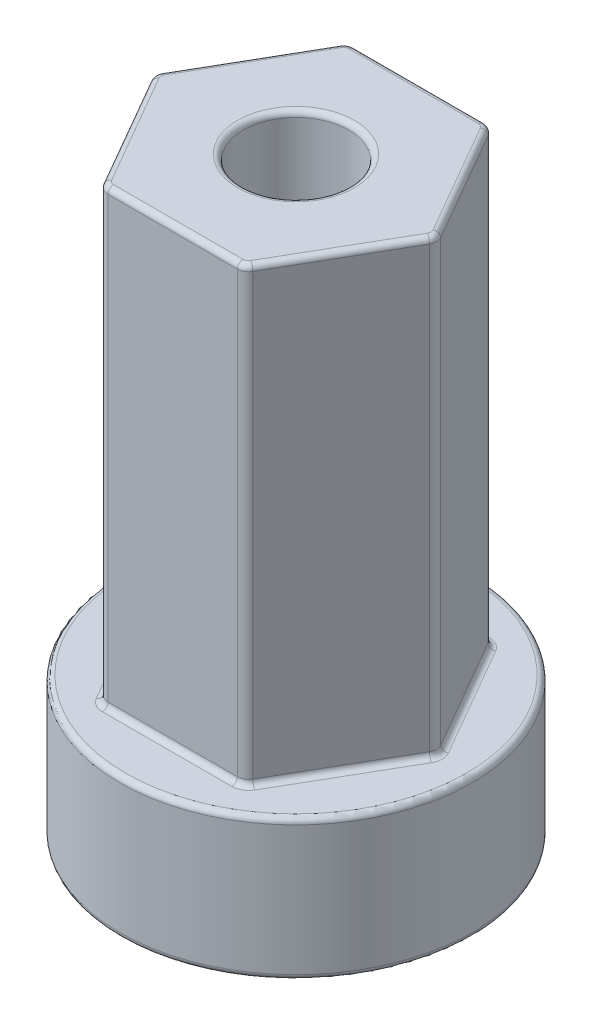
SolidWorks part; units mm, degrees
ref_plane "Front" through (0, 0, 0) normal (0, 0, 1) x (1, 0, 0)
ref_plane "Top" through (0, 0, 0) normal (0, 1, 0) x (1, 0, 0)
ref_plane "Right" through (0, 0, 0) normal (1, 0, 0) x (0, 0, -1)
sketch "Sketch1" plane through (0, 0, 0) normal (0, 1, 0) x (1, 0, 0)
  circle A0 centre (0, 0) radius 7.9375
  dimension "D1" = 15.875
extrude "Extrude1" add sketch "Sketch1" along normal blind 6.35
sketch "Sketch2" plane through (0, 6.35, 0) normal (0, 1, 0) x (-1, 0, 0)
  line L1 (6.4158, 0) -> (3.2079, 5.5563)
  line L2 (3.2079, 5.5563) -> (-3.2079, 5.5563)
  line L3 (-3.2079, 5.5563) -> (-6.4158, 0)
  line L4 (-6.4158, 0) -> (-3.2079, -5.5562)
  line L5 (-3.2079, -5.5562) -> (3.2079, -5.5562)
  line L6 (3.2079, -5.5562) -> (6.4158, 0)
  circle A0 centre (0, 0) radius 5.5562 construction
  dimension "D1" = 11.1125
extrude "Extrude2" add sketch "Sketch2" along normal blind 20.32
sketch "Sketch3" plane through (0, 26.67, 0) normal (0, 1, 0) x (-1, 0, 0)
  circle A0 centre (0, 0) radius 2.3813
  dimension "D1" = 4.7625
extrude "Cut-Extrude1" cut sketch "Sketch3" against normal through all
fillet "Fillet1" radius 0.508 6 edges at (6.4158, 16.51, 0) (3.2079, 16.51, -5.5562) (-3.2079, 16.51, -5.5562) (-6.4158, 16.51, 0) (-3.2079, 16.51, 5.5563) (3.2079, 16.51, 5.5563)
fillet "Fillet2" radius 0.254 28 edges at (0, 0, 7.9375) (0, 0, 2.3813) (0, 26.67, 2.3813) (-4.8119, 6.35, -2.7781) (-4.8119, 26.67, -2.7781) (0, 6.35, -5.5562) (0, 26.67, -5.5562) (-4.8119, 26.67, 2.7781) (0, 26.67, 5.5563) (4.8119, 26.67, 2.7781) (4.8119, 26.67, -2.7781) (-6.3372, 26.67, 0) (-3.1686, 26.67, 5.4882) (3.1686, 26.67, 5.4882) (6.3372, 26.67, 0) (3.1686, 26.67, -5.4882) (-3.1686, 26.67, -5.4882) (4.8119, 6.35, -2.7781) (4.8119, 6.35, 2.7781) (0, 6.35, 7.9375) (0, 6.35, 5.5563) (-4.8119, 6.35, 2.7781) (-3.1686, 6.35, -5.4882) (3.1686, 6.35, -5.4882) (6.3372, 6.35, 0) (3.1686, 6.35, 5.4882) (-3.1686, 6.35, 5.4882) (-6.3372, 6.35, 0)
